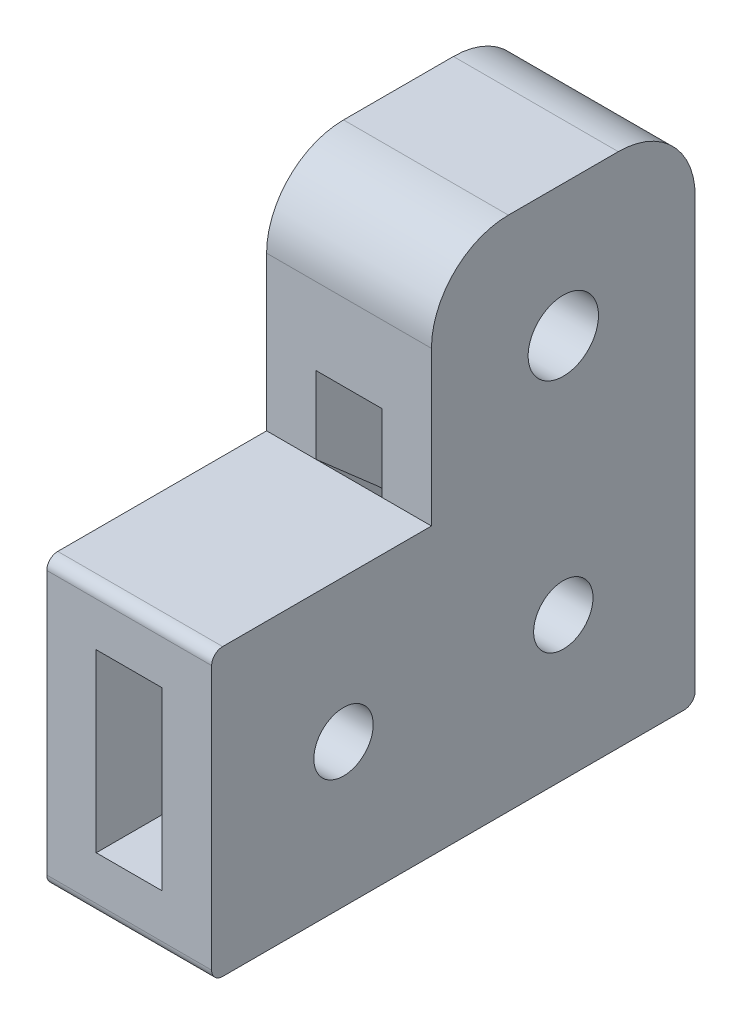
SolidWorks part; units mm, degrees
ref_plane "正面" through (0, 0, 0) normal (1, 0, 0) x (0, 1, 0)
ref_plane "平面" through (0, 0, 0) normal (0, 0, 1) x (0, 1, 0)
ref_plane "右側面" through (0, 0, 0) normal (0, 1, 0) x (-1, 0, 0)
sketch "ｽｹｯﾁ1" plane through (0, 0, 0) normal (1, 0, 0) x (0, 1, 0)
  line L0 (-21, 20) -> (-21, -24)
  line L1 (-21, -24) -> (26, -24)
  line L2 (26, -24) -> (26, 0)
  line L3 (26, 0) -> (5, 0)
  line L4 (5, 0) -> (5, 20)
  line L5 (5, 20) -> (-21, 20)
  circle A0 centre (-8, 8) radius 2.7
  circle A1 centre (-8, -12) radius 2.7
  circle A2 centre (14, -12) radius 3.2
  dimension "D5" = 5.4
  dimension "D6" = 5.4
  dimension "D7" = 6.4
  dimension "D1" = 44
  dimension "D2" = 47
  dimension "D3" = 24
  dimension "D4" = 26
  dimension "D8" = 12
  dimension "D9" = 32
  dimension "D10" = 12
  dimension "D11" = 13
  dimension "D12" = 13
  dimension "D13" = 35
extrude "ﾎﾞｽ - 押し出し1" add sketch "ｽｹｯﾁ1" along normal mid plane 15
sketch "ｽｹｯﾁ2" plane through (0, 0, 0) normal (0, 0, 1) x (1, 0, 0)
  line L0 (7.5, 5) -> (-7.5, 5) construction
  line L1 (-3, 12) -> (3, 12)
  line L2 (-3, 12) -> (-3, 5)
  line L3 (-3, 5) -> (3, 5)
  line L4 (3, 12) -> (3, 5)
  line L5 (-3, 12) -> (3, 5) construction
  line L6 (-3, 5) -> (3, 12) construction
  line L7 (-7.5, 26) -> (-7.5, 5) construction
  point P0 (0, 8.5)
  dimension "D1" = 7
  dimension "D2" = 6
  dimension "D3" = 7.5
sketch "ｽｹｯﾁ3" plane through (0, 0, -24) normal (0, 0, -1) x (1, 0, 0)
  line L0 (7.5, 21) -> (7.5, -26) construction
  line L1 (-3, 16) -> (3, 16)
  line L2 (-3, 16) -> (-3, 0)
  line L3 (-3, 0) -> (3, 0)
  line L4 (3, 16) -> (3, 0)
  line L5 (-3, 16) -> (3, 0) construction
  line L6 (-3, 0) -> (3, 16) construction
  line L8 (7.5, 21) -> (-7.5, 21) construction
  point P0 (0, 8)
  dimension "D1" = 6
  dimension "D2" = 16
  dimension "D3" = 7.5
  dimension "D4" = 13
loft "ｶｯﾄ - ﾛﾌﾄ1" cut profiles "ｽｹｯﾁ3", "ｽｹｯﾁ2"
fillet "ﾌｨﾚｯﾄ2" radius 7 2 edges at (0, 26, -24) (0, 26, 0)
sketch "ｽｹｯﾁ4" plane through (0, 0, -24) normal (0, 0, -1) x (1, 0, 0)
  line L0 (7.5, 21) -> (7.5, -19) construction
  line L1 (-3, 16) -> (3, 16)
  line L2 (-3, 16) -> (-3, 0)
  line L3 (-3, 0) -> (3, 0)
  line L4 (3, 16) -> (3, 0)
  line L5 (-3, 16) -> (3, 0) construction
  line L6 (-3, 0) -> (3, 16) construction
  line L7 (7.5, 21) -> (-7.5, 21) construction
  point P0 (0, 8)
  dimension "D1" = 16
  dimension "D2" = 6
  dimension "D3" = 7.5
  dimension "D4" = 13
extrude "ｶｯﾄ - 押し出し1" cut sketch "ｽｹｯﾁ4" against normal through all
fillet "ﾌｨﾚｯﾄ3" radius 1 3 edges at (0, -21, -24) (0, -21, 20) (0, 5, 20)
